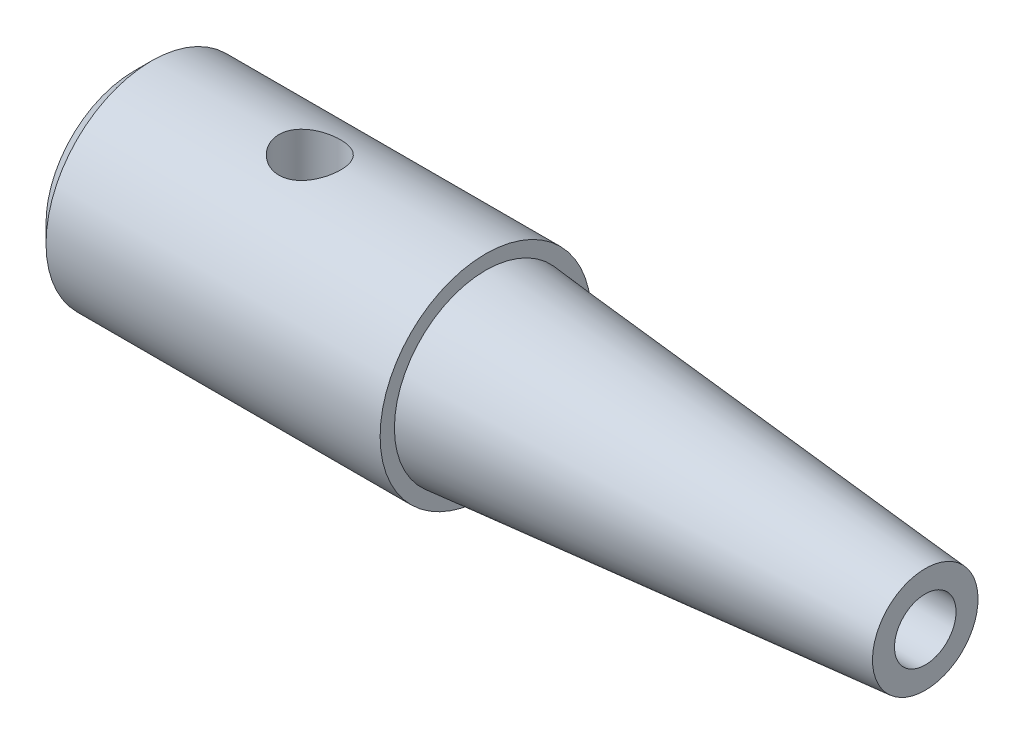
SolidWorks part; units mm, degrees
ref_plane "Front" through (0, 0, 0) normal (0, 0, 1) x (1, 0, 0)
ref_plane "Top" through (0, 0, 0) normal (0, 1, 0) x (1, 0, 0)
ref_plane "Right" through (0, 0, 0) normal (1, 0, 0) x (0, 0, -1)
sketch "Sketch1" plane through (0, 0, 0) normal (0, 0, 1) x (1, 0, 0)
  line L0 (0, 0) -> (23.9896, 0)
  line L1 (0, 0) -> (0, 6)
  line L2 (0, 6) -> (20, 6)
  line L3 (45, 1.75) -> (45, 3)
  line L4 (45, 3) -> (20, 5.1872)
  line L5 (20, 6) -> (20, 5.1872)
  line L7 (25, 1.75) -> (45, 1.75)
  line L8 (25, 1.75) -> (23.9896, 0)
  line L9 (0, 1.75) -> (45, 1.75) construction
  line L11 (0, 0) -> (45, 0) construction
revolve "Revolve1" add sketch "Sketch1" angle 360 about L0
sketch "Sketch2" plane through (0, 0, 0) normal (0, 1, 0) x (1, 0, 0)
  circle A0 centre (10, 0) radius 1.75
extrude "Cut-Extrude1" cut sketch "Sketch2" against normal mid plane 20
chamfer "Chamfer1" distance 1 angle 45 1 edges at (0, -6, 0)
